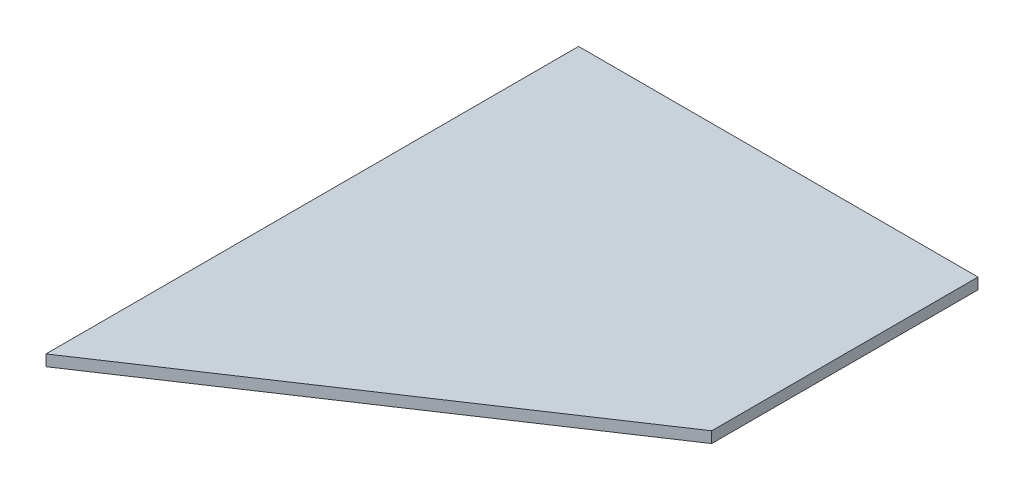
SolidWorks part; units mm, degrees
ref_plane "Front Plane" through (0, 0, 0) normal (1, 0, 0) x (0, 1, 0)
ref_plane "Top Plane" through (0, 0, 0) normal (0, 0, 1) x (0, 1, 0)
ref_plane "Right Plane" through (0, 0, 0) normal (0, 1, 0) x (-1, 0, 0)
sketch "Sketch1" plane through (0, 0, 0) normal (1, 0, 0) x (0, 1, 0)
  line L1 (-158.75, -152.4) -> (-152.4, -152.4)
  line L2 (-158.75, -152.4) -> (-158.75, 152.4)
  line L3 (-158.75, 152.4) -> (-152.4, 152.4)
  line L4 (-152.4, -152.4) -> (-152.4, 152.4)
ref_plane "Plane1" through (304.8, 0, 0) normal (1, 0, 0) x (0, 1, 0)
sketch "Sketch2" plane through (304.8, 0, 0) normal (1, 0, 0) x (0, 1, 0)
  line L1 (-82.55, -76.2) -> (-76.2, -76.2)
  line L2 (-82.55, -76.2) -> (-82.55, 76.2)
  line L3 (-82.55, 76.2) -> (-76.2, 76.2)
  line L4 (-76.2, -76.2) -> (-76.2, 76.2)
loft "Tapered_plywood_panel" add profiles "Sketch1", "Sketch2"
